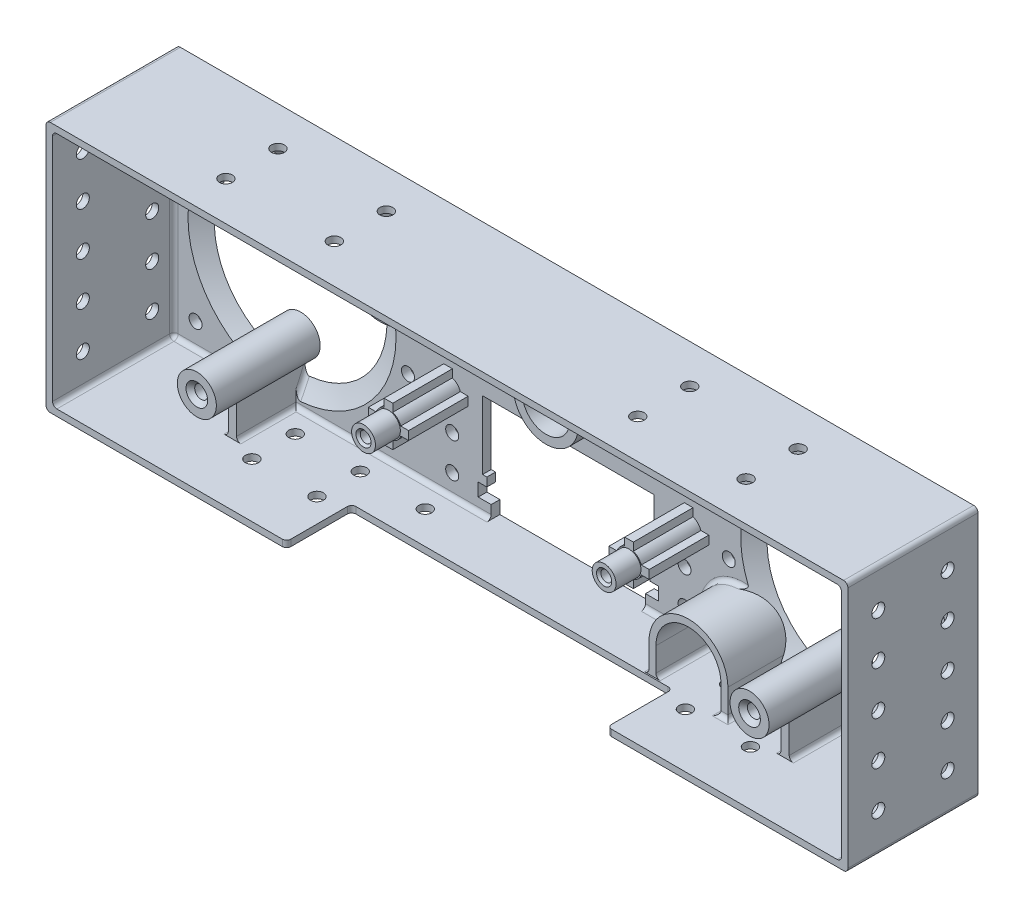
SolidWorks part; units mm, degrees
ref_plane "Front Plane" through (0, 0, 0) normal (0, 0, 1) x (1, 0, 0)
ref_plane "Top Plane" through (0, 0, 0) normal (0, 1, 0) x (1, 0, 0)
ref_plane "Right Plane" through (0, 0, 0) normal (1, 0, 0) x (0, 0, -1)
body saved out of another part "Stock-original_AC_box-1"
sketch "Sketch1" plane through (0, 0, 0) normal (0, 0, 1) x (1, 0, 0)
  line L0 (-91, 0) -> (91, 0) construction
  line L1 (0, -29) -> (0, 29) construction
  line L2 (-92.5, -29) -> (92.5, -29) construction
  line L3 (-92.5, 29) -> (92.5, 29) construction
  line L4 (-92.5, 29) -> (92.5, 29)
  line L5 (-92.5, -29) -> (92.5, -29)
  line L6 (-92.5, 29) -> (-92.5, -29) construction
  line L7 (-92.5, 29) -> (-92.5, -29)
  line L8 (92.5, 29) -> (92.5, -29) construction
  line L9 (92.5, 29) -> (92.5, -29)
  line L39 (71.7, 22.5) -> (71.7, 20.645)
  line L40 (64.7, -25.9812) -> (64.7, -27.5)
  line L41 (64.7, -27.5) -> (91, -27.5)
  line L42 (91, -27.5) -> (91, 27.5)
  line L43 (91, 27.5) -> (1, 27.5)
  line L44 (1, 27.5) -> (1, 25.5)
  line L45 (1, 25.5) -> (-1, 25.5)
  line L46 (-1, 25.5) -> (-1, 27.5)
  line L47 (-1, 27.5) -> (-21.65, 27.5)
  line L48 (-21.65, 27.5) -> (-21.65, 21)
  line L49 (-39.85, 21) -> (-39.85, 27.5)
  line L50 (-39.85, 27.5) -> (-91, 27.5)
  line L51 (-91, 27.5) -> (-91, -27.5)
  line L52 (-91, -27.5) -> (-64.7, -27.5)
  line L53 (-64.7, -27.5) -> (-64.7, -25.9812)
  line L54 (-71.7, 20.645) -> (-71.7, 22.5)
  line L55 (-71.7, 22.5) -> (-55.8, 22.5)
  line L56 (-55.8, 22.5) -> (-55.8, 20.645)
  line L57 (-62.8, -25.9812) -> (-62.8, -27.5)
  line L58 (-62.8, -27.5) -> (-17.8, -27.5)
  line L59 (-17.8, -27.5) -> (-17.8, -24.5)
  line L60 (-17.8, -24.5) -> (-20.8, -24.5)
  line L61 (-20.8, -24.5) -> (-20.8, -21.5)
  line L62 (-20.8, -21.5) -> (-18.8, -21.5)
  line L63 (-18.8, -21.5) -> (-18.8, -19.5)
  line L64 (-18.8, -19.5) -> (-19.8, -19.5)
  line L65 (-19.8, -19.5) -> (-19.8, -3.75)
  line L66 (-19.8, -3.75) -> (19.8, -3.75)
  line L67 (19.8, -3.75) -> (19.8, -19.5)
  line L68 (19.8, -19.5) -> (18.8, -19.5)
  line L69 (18.8, -19.5) -> (18.8, -21.5)
  line L70 (18.8, -21.5) -> (20.8, -21.5)
  line L71 (20.8, -21.5) -> (20.8, -24.5)
  line L72 (20.8, -24.5) -> (17.8, -24.5)
  line L73 (17.8, -24.5) -> (17.8, -27.5)
  line L74 (17.8, -27.5) -> (31.3, -27.5)
  line L75 (31.3, -27.5) -> (31.3, -21)
  line L76 (55.8, 20.645) -> (55.8, 22.5)
  line L77 (55.8, 22.5) -> (71.7, 22.5)
  line L78 (71.7, 22.5) -> (71.7, 20.645)
  line L79 (64.7, -25.9812) -> (64.7, -27.5)
  line L80 (64.7, -27.5) -> (91, -27.5)
  line L81 (91, -27.5) -> (91, 27.5)
  line L82 (91, 27.5) -> (1, 27.5)
  line L83 (1, 27.5) -> (1, 25.5)
  line L84 (1, 25.5) -> (-1, 25.5)
  line L85 (-1, 25.5) -> (-1, 27.5)
  line L86 (-1, 27.5) -> (-21.65, 27.5)
  line L87 (-21.65, 27.5) -> (-21.65, 21)
  line L88 (-39.85, 21) -> (-39.85, 27.5)
  line L89 (-39.85, 27.5) -> (-91, 27.5)
  line L90 (-91, 27.5) -> (-91, -27.5)
  line L91 (-91, -27.5) -> (-64.7, -27.5)
  line L92 (-64.7, -27.5) -> (-64.7, -25.9812)
  line L93 (-71.7, 20.645) -> (-71.7, 22.5)
  line L94 (-71.7, 22.5) -> (-55.8, 22.5)
  line L95 (-55.8, 22.5) -> (-55.8, 20.645)
  line L96 (-62.8, -25.9812) -> (-62.8, -27.5)
  line L97 (-62.8, -27.5) -> (-17.8, -27.5)
  line L98 (-17.8, -27.5) -> (-17.8, -24.5)
  line L99 (-17.8, -24.5) -> (-20.8, -24.5)
  line L100 (-20.8, -24.5) -> (-20.8, -21.5)
  line L101 (-20.8, -21.5) -> (-18.8, -21.5)
  line L102 (-18.8, -21.5) -> (-18.8, -19.5)
  line L103 (-18.8, -19.5) -> (-19.8, -19.5)
  line L104 (-19.8, -19.5) -> (-19.8, -3.75)
  line L105 (-19.8, -3.75) -> (19.8, -3.75)
  line L106 (19.8, -3.75) -> (19.8, -19.5)
  line L107 (19.8, -19.5) -> (18.8, -19.5)
  line L108 (18.8, -19.5) -> (18.8, -21.5)
  line L109 (18.8, -21.5) -> (20.8, -21.5)
  line L110 (20.8, -21.5) -> (20.8, -24.5)
  line L111 (20.8, -24.5) -> (17.8, -24.5)
  line L112 (17.8, -24.5) -> (17.8, -27.5)
  line L113 (17.8, -27.5) -> (31.3, -27.5)
  line L114 (31.3, -27.5) -> (31.3, -21)
  line L115 (55.8, 20.645) -> (55.8, 22.5)
  line L116 (55.8, 22.5) -> (71.7, 22.5)
  circle A0 centre (-86, 15.5) radius 1.5
  circle A2 centre (-86, -22) radius 1.5
  circle A3 centre (-37, -8) radius 1.5
  circle A4 centre (-30, 5) radius 1.5
  arc A6 (64.7, -25.9812) -> (71.7, 20.645) centre (63.75, -2) ccw
  arc A7 (-39.85, 21) -> (-21.65, 21) centre (-30.75, 21) ccw
  arc A8 (-71.7, 20.645) -> (-64.7, -25.9812) centre (-63.75, -2) ccw
  arc A9 (-62.8, -25.9812) -> (-55.8, 20.645) centre (-63.75, -2) ccw
  arc A10 (41.9475, -12.0325) -> (31.3, -21) centre (40.4, -21) ccw
  arc A11 (55.8, 20.645) -> (41.9475, -12.0325) centre (63.75, -2) ccw
  arc A12 (64.7, -25.9812) -> (71.7, 20.645) centre (63.75, -2) ccw
  arc A13 (-39.85, 21) -> (-21.65, 21) centre (-30.75, 21) ccw
  arc A14 (-71.7, 20.645) -> (-64.7, -25.9812) centre (-63.75, -2) ccw
  arc A15 (-62.8, -25.9812) -> (-55.8, 20.645) centre (-63.75, -2) ccw
  arc A16 (41.9475, -12.0325) -> (31.3, -21) centre (40.4, -21) ccw
  arc A17 (55.8, 20.645) -> (41.9475, -12.0325) centre (63.75, -2) ccw
  circle A20 centre (30, 5) radius 1.5
  circle A21 centre (86, -22) radius 1.5
  circle A22 centre (86, 15.5) radius 1.5
  circle A23 centre (37, -8) radius 1.5
  dimension "D2" = 3
  dimension "D5" = 3
  dimension "D9" = 3
  dimension "D11" = 3
  dimension "D3" = 5
  dimension "D4" = 12
  dimension "D6" = 5.5
  dimension "D7" = 5
  dimension "D8" = 30
  dimension "D10" = 5
  dimension "D12" = 8
  dimension "D13" = 37
  dimension "D1" = 0
extrude "Cut-Extrude1" cut sketch "Sketch1" against normal through all contours A0 | A2 | A4 | A3 | A20 | A23 | A21 | A22
sketch "Sketch2" plane through (0, 29, 0) normal (0, 1, 0) x (1, 0, 0)
  line L0 (-92.5, -13) -> (92.5, -13) construction
  line L1 (0, 2) -> (0, -28) construction
  line L2 (-60, -7) -> (-35, -7) construction
  line L3 (60, -7) -> (35, -7) construction
  line L4 (-92.5, 2) -> (-92.5, -28)
  line L5 (-92.5, -28) -> (92.5, -28)
  line L6 (92.5, -28) -> (92.5, 2)
  line L7 (92.5, 2) -> (-92.5, 2)
  line L8 (-92.5, 2) -> (-92.5, -28)
  line L9 (-92.5, -28) -> (92.5, -28)
  line L10 (92.5, -28) -> (92.5, 2)
  line L11 (92.5, 2) -> (-92.5, 2)
  circle A0 centre (-60, -7) radius 1.5
  circle A1 centre (-60, -19) radius 1.5
  circle A2 centre (60, -7) radius 1.5
  circle A3 centre (60, -19) radius 1.5
  circle A4 centre (-35, -7) radius 1.5
  circle A5 centre (-35, -19) radius 1.5
  circle A6 centre (35, -7) radius 1.5
  circle A7 centre (35, -19) radius 1.5
  point P11 (-92.5, -13)
  dimension "D3" = 3
  dimension "D2" = 60
  dimension "D4" = 6
  dimension "D5" = 25
  dimension "D6" = 25
  dimension "D1" = 0
extrude "Cut-Extrude2" cut sketch "Sketch2" against normal blind 2 and the other way through all flip side to cut
sketch "Sketch3" plane through (0, -29, 0) normal (0, -1, 0) x (1, 0, 0)
  line L0 (0, 28) -> (0, -2) construction
  line L1 (-37, 28) -> (-37, 13)
  line L2 (-37, 13) -> (37, 13)
  line L3 (37, 28) -> (37, 13)
  line L4 (92.5, -2) -> (92.5, 28)
  line L5 (92.5, 28) -> (-92.5, 28)
  line L6 (-92.5, 28) -> (-92.5, -2)
  line L7 (-92.5, -2) -> (92.5, -2)
  line L8 (92.5, -2) -> (92.5, 28)
  line L9 (92.5, 28) -> (-92.5, 28)
  line L10 (-92.5, 28) -> (-92.5, -2)
  line L11 (-92.5, -2) -> (92.5, -2)
  point P10 (0, 13)
  dimension "D2" = 15
  dimension "D3" = 37
  dimension "D1" = 0
extrude "Cut-Extrude3" cut sketch "Sketch3" against normal up to next contours L0 L9 L1 L2 | L0 L2 L3 M9
fillet "Fillet1" radius 1 4 edges at (37, -28.25, 28) (37, -28.25, 13) (-37, -28.25, 28) (-37, -28.25, 13)
chamfer "Chamfer1" distance 1 angle 45 2 edges at (65.25, -14.5, 21.95) (-62.25, -14.5, 21.95)
chamfer "Chamfer2" distance 0.5 angle 45 4 edges at (84.5, 22.75, 17.75) (-82, 22.75, 17.75) (-26.5, -6.5, 19.5) (29, -6.5, 19.5)
sketch "Sketch4" plane through (92.5, 0, 0) normal (1, 0, 0) x (0, 0, -1)
  line L0 (-13, 29) -> (-13, -29) construction
  line L1 (-28, 0) -> (2, 0) construction
  line L2 (-21, 0) -> (-21, 10) construction
  line L3 (-21, 0) -> (-21, -10) construction
  line L4 (-28, 29) -> (-28, -29)
  line L5 (-28, -29) -> (2, -29)
  line L6 (2, -29) -> (2, 29)
  line L7 (2, 29) -> (-28, 29)
  line L8 (-28, 29) -> (-28, -29)
  line L9 (-28, -29) -> (2, -29)
  line L10 (2, -29) -> (2, 29)
  line L11 (2, 29) -> (-28, 29)
  circle A0 centre (-21, 0) radius 1.5
  circle A1 centre (-5, 0) radius 1.5
  circle A2 centre (-21, 10) radius 1.5
  circle A3 centre (-5, 10) radius 1.5
  circle A4 centre (-21, 20) radius 1.5
  circle A5 centre (-5, 20) radius 1.5
  circle A6 centre (-21, 0) radius 1.5
  circle A7 centre (-5, 0) radius 1.5
  circle A8 centre (-21, 10) radius 1.5
  circle A9 centre (-5, 10) radius 1.5
  circle A10 centre (-21, -10) radius 1.5
  circle A11 centre (-5, -10) radius 1.5
  circle A12 centre (-21, 0) radius 1.5
  circle A13 centre (-5, 0) radius 1.5
  circle A14 centre (-21, -10) radius 1.5
  circle A15 centre (-5, -10) radius 1.5
  circle A16 centre (-21, -20) radius 1.5
  circle A17 centre (-5, -20) radius 1.5
  dimension "D2" = 3
  dimension "D3" = 8
  dimension "D6" = 10
  dimension "D7" = 10
  dimension "D8" = 180
  dimension "D1" = 0
  dimension "D4" = 3
  dimension "D5" = 3
extrude "Cut-Extrude4" cut sketch "Sketch4" against normal up to surface (1.5 mm away) contours A5 | A4 | A2 | A3 | A11 | A10 | A17 | A16 | A1 | A0
sketch "Sketch5" plane through (-92.5, 0, 0) normal (-1, 0, 0) x (0, 0, 1)
  line L4 (28, -29) -> (28, 29)
  line L5 (-2, -29) -> (28, -29)
  line L6 (-2, 29) -> (-2, -29)
  line L7 (28, 29) -> (-2, 29)
  line L8 (28, -29) -> (28, 29)
  line L9 (-2, -29) -> (28, -29)
  line L10 (-2, 29) -> (-2, -29)
  line L11 (28, 29) -> (-2, 29)
  circle A1 centre (5, 0) radius 1.5
  circle A2 centre (5, 0) radius 1.5
  circle A3 centre (21, 0) radius 1.5
  circle A4 centre (21, 0) radius 1.5
  circle A5 centre (5, 10) radius 1.5
  circle A6 centre (5, 10) radius 1.5
  circle A7 centre (21, 10) radius 1.5
  circle A8 centre (21, 10) radius 1.5
  circle A9 centre (5, 0) radius 1.5
  circle A10 centre (5, 0) radius 1.5
  circle A11 centre (21, 0) radius 1.5
  circle A12 centre (21, 0) radius 1.5
  circle A13 centre (5, 20) radius 1.5
  circle A14 centre (5, 20) radius 1.5
  circle A15 centre (21, 20) radius 1.5
  circle A16 centre (21, 20) radius 1.5
  circle A17 centre (5, 10) radius 1.5
  circle A18 centre (5, 10) radius 1.5
  circle A19 centre (21, 10) radius 1.5
  circle A20 centre (21, 10) radius 1.5
  circle A21 centre (5, -20) radius 1.5
  circle A22 centre (5, -20) radius 1.5
  circle A23 centre (21, -20) radius 1.5
  circle A24 centre (21, -20) radius 1.5
  circle A25 centre (5, -10) radius 1.5
  circle A26 centre (5, -10) radius 1.5
  circle A27 centre (21, -10) radius 1.5
  circle A28 centre (21, -10) radius 1.5
  circle A29 centre (5, 0) radius 1.5
  circle A30 centre (5, 0) radius 1.5
  circle A31 centre (21, 0) radius 1.5
  circle A32 centre (21, 0) radius 1.5
  circle A33 centre (5, -10) radius 1.5
  circle A34 centre (5, -10) radius 1.5
  circle A35 centre (21, -10) radius 1.5
  circle A36 centre (21, -10) radius 1.5
  dimension "D1" = 0
  dimension "D2" = 0
  dimension "D3" = 0
  dimension "D4" = 0
  dimension "D5" = 0
  dimension "D6" = 0
  dimension "D7" = 0
  dimension "D8" = 0
  dimension "D9" = 0
  dimension "D10" = 0
  dimension "D11" = 0
  dimension "D12" = 0
  dimension "D13" = 0
  dimension "D14" = 0
  dimension "D15" = 0
  dimension "D16" = 0
  dimension "D17" = 0
  dimension "D18" = 0
  dimension "D19" = 0
extrude "Cut-Extrude5" cut sketch "Sketch5" against normal up to surface (1.5 mm away) contours A14 | A6 | A2 | A26 | A22 | A24 | A28 | A4 | A8 | A16
sketch "Sketch6" plane through (0, -29, 0) normal (0, -1, 0) x (1, 0, 0)
  line L0 (0, 13) -> (0, -2) construction
  line L1 (-42.5, 5.5) -> (0, 5.5) construction
  line L2 (-42.5, 5.5) -> (-27.5, 5.5) construction
  line L3 (-42.5, 5.5) -> (-57.5, 5.5) construction
  line L4 (-57.5, 5.5) -> (-57.5, 15.5) construction
  line L5 (57.5, 5.5) -> (57.5, 15.5) construction
  line L6 (42.5, 5.5) -> (57.5, 5.5) construction
  line L7 (42.5, 5.5) -> (27.5, 5.5) construction
  line L8 (92.5, 28) -> (38, 28)
  line L9 (37, 27) -> (37, 14)
  line L10 (36, 13) -> (-36, 13)
  line L11 (-37, 14) -> (-37, 27)
  line L12 (-38, 28) -> (-92.5, 28)
  line L13 (-92.5, 28) -> (-92.5, -2)
  line L14 (-92.5, -2) -> (92.5, -2)
  line L15 (92.5, -2) -> (92.5, 28)
  line L16 (92.5, 28) -> (38, 28)
  line L17 (37, 27) -> (37, 14)
  line L18 (36, 13) -> (-36, 13)
  line L19 (-37, 14) -> (-37, 27)
  line L20 (-38, 28) -> (-92.5, 28)
  line L21 (-92.5, 28) -> (-92.5, -2)
  line L22 (-92.5, -2) -> (92.5, -2)
  line L23 (92.5, -2) -> (92.5, 28)
  circle A0 centre (-42.5, 5.5) radius 1.5
  circle A1 centre (-27.5, 5.5) radius 1.5
  circle A2 centre (-57.5, 5.5) radius 1.5
  circle A3 centre (-57.5, 15.5) radius 1.5
  arc A4 (38, 28) -> (37, 27) centre (38, 27) ccw
  arc A5 (36, 13) -> (37, 14) centre (36, 14) ccw
  arc A6 (-37, 14) -> (-36, 13) centre (-36, 14) ccw
  arc A7 (-37, 27) -> (-38, 28) centre (-38, 27) ccw
  arc A8 (38, 28) -> (37, 27) centre (38, 27) ccw
  arc A9 (36, 13) -> (37, 14) centre (36, 14) ccw
  arc A10 (-37, 14) -> (-36, 13) centre (-36, 14) ccw
  arc A11 (-37, 27) -> (-38, 28) centre (-38, 27) ccw
  circle A12 centre (-42.5, 15.5) radius 1.5
  circle A13 centre (42.5, 15.5) radius 1.5
  circle A14 centre (57.5, 15.5) radius 1.5
  circle A15 centre (57.5, 5.5) radius 1.5
  circle A16 centre (27.5, 5.5) radius 1.5
  circle A17 centre (42.5, 5.5) radius 1.5
  dimension "D2" = 3
  dimension "D3" = 42.5
  dimension "D4" = 15
  dimension "D6" = 15
  dimension "D8" = 10
  dimension "D1" = 0
  dimension "D5" = 2
  dimension "D7" = 2
  dimension "D9" = 2
extrude "Cut-Extrude6" cut sketch "Sketch6" against normal up to surface (1.5 mm away) contours A3 | A2 | A12 | A0 | A1 | A16 | A17 | A13 | A14 | A15
fillet "Fillet2" radius 1 49 edges at (-62.8, -23.9622, -1.0465) (-64.7, -23.9622, -1.0465) (64.7, -23.9622, -1.0465) (62.8, -23.9622, -1.0465) (46, 27.5, 0) (-11.325, 27.5, 0) (-65.425, 27.5, 0) (91, 0, 0) (77.85, -27.5, 0) (56.15, -27.5, 0) (24.55, -27.5, 0) (-40.3, -27.5, 0) (-77.85, -27.5, 0) (-91, 0, 0) (-91, 27.5, 14) (-91, -27.5, 14) (91, -27.5, 14) (91, 27.5, 14) (49.5, -24.4058, 0) (34.5379, -14.0397, 0) (31.3, -24.25, 0) (49.5, -27.5, 6.35) (31.3, -27.5, 6.35) (-39.85, 24.25, 0) (-30.75, 11.9, 0) (-21.65, 24.25, 0) (-39.85, 27.5, 6.35) (64.7, -18.8986, 5.875) (64.7, -27.5, 6.875) (62.8, -27.5, 6.875) (62.8, -18.8986, 5.875) (-62.8, -18.8986, 5.875) (-62.8, -27.5, 6.875) (-64.7, -27.5, 6.875) (-64.7, -18.8986, 5.875) (83.25, 27.4, 0) (-83.25, 27.4, 0) (32.9, -27.5, 5.35) (47.9, -27.5, 5.35) (-23.25, 27.5, 5.35) (-38.25, 27.5, 5.35) (-92.5, 29, 13) (-92.5, -29, 13) (92.5, -29, 13) (92.5, 29, 13) (-64.7, -20.3981, -2) (-62.8, -20.3981, -2) (62.8, -20.3981, -2) (64.7, -20.3981, -2)
sketch "Sketch7" plane through (0, 0, -2) normal (0, 0, -1) x (-1, 0, 0)
  line L0 (19.8, -3.75) -> (19.8, -19.5) construction
  line L1 (91.5, -29) -> (-91.5, -29) construction
  line L2 (0, 16.5119) -> (0, -16.5119) construction
  circle A0 centre (26.8, -14.6408) radius 1.5
  circle A1 centre (26.8, -22.6408) radius 1.5
  circle A2 centre (-26.8, -22.6408) radius 1.5
  circle A3 centre (-26.8, -14.6408) radius 1.5
  dimension "D1" = 8
  dimension "D2" = 7
  dimension "D4" = 3
  dimension "D5" = 3
  dimension "D3" = 6.3592
extrude "Cut-Extrude7" cut sketch "Sketch7" against normal blind 10
